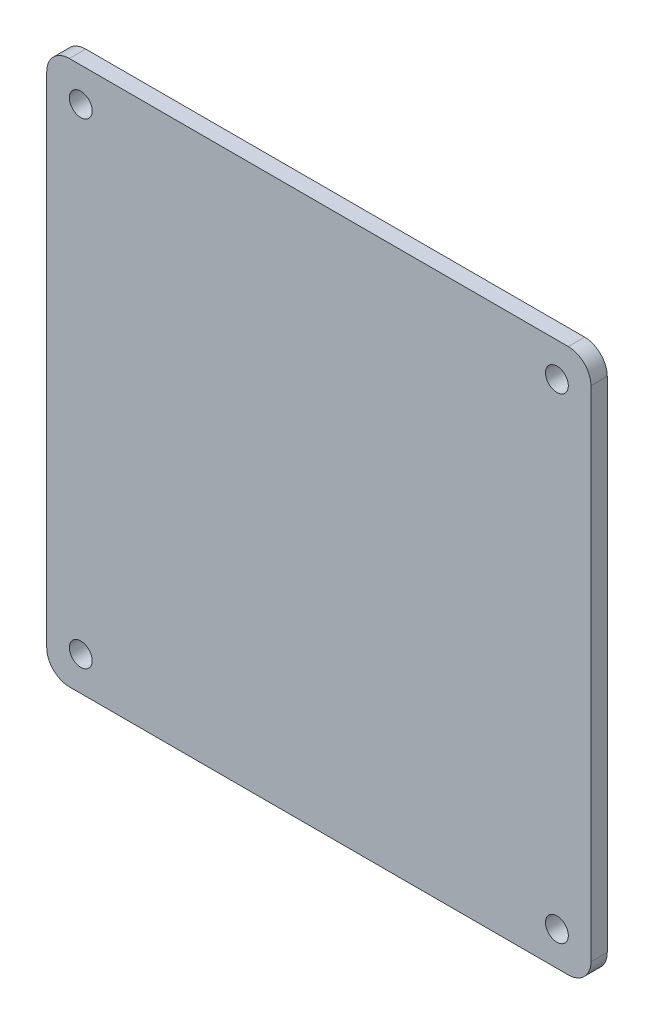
SolidWorks part; units mm, degrees
ref_plane "Front Plane" through (0, 0, 0) normal (0, 0, 1) x (1, 0, 0)
ref_plane "Top Plane" through (0, 0, 0) normal (0, 1, 0) x (1, 0, 0)
ref_plane "Right Plane" through (0, 0, 0) normal (1, 0, 0) x (0, 0, -1)
imported_body "Imported1"
hole_wizard "M4 Clearance Hole1" positions "Sketch1" profile "Sketch2" hole size "M4" standard "ANSI Metric"
sketch "Sketch1" plane through (0, 0, 3.429) normal (0, 0, 1) x (1, 0, 0)
  line L0 (-50, -50) -> (-50, 50) construction
  line L1 (-50, 50) -> (50, 50) construction
  line L2 (-57.15, -52.3875) -> (-57.15, 52.3875) construction
  line L3 (-52.3875, 57.15) -> (52.3875, 57.15) construction
  point P6 (-50, 50)
  point P7 (50, 50)
  point P8 (-50, -50)
  point P9 (-50, -50)
  point P10 (50, -50)
  point P15 (0, 50)
  point P16 (0, 0)
  point P17 (-50, 0)
  point P20 (-57.15, 0)
  point P23 (0, 57.15)
  dimension "D1" = 100
  dimension "D2" = 100
sketch "Sketch2" plane through (-50, 50, 3.429) normal (1, 0, 0) x (0, -1, 0)
  line L0 (0, 0) -> (0, 3.429)
  line L1 (0, 3.429) -> (2.4, 3.429)
  line L2 (2.4, 3.429) -> (2.4, 0)
  line L5 (2.4, 0) -> (0, 0)
  line L11 (0, -6.35) -> (0, 107.95) construction
  dimension "Thru Hole Dia." = 4.8
  dimension "Thru Hole Depth" = 3.429
